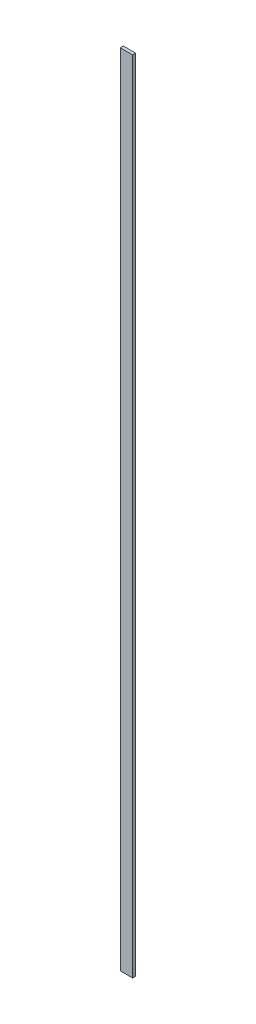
SolidWorks part; units mm, degrees
ref_plane "Přední" through (0, 0, 0) normal (0, 0, 1) x (1, 0, 0)
ref_plane "Horní" through (0, 0, 0) normal (0, 1, 0) x (1, 0, 0)
ref_plane "Pravá" through (0, 0, 0) normal (1, 0, 0) x (0, 0, -1)
sketch "Skica1" plane through (0, 0, 0) normal (0, 0, 1) x (1, 0, 0)
  line L0 (10, 650) -> (-10, -650) construction
  line L1 (-10, 650) -> (10, 650)
  line L2 (-10, 650) -> (-10, -650)
  line L3 (-10, -650) -> (10, -650)
  line L4 (10, 650) -> (10, -650)
  dimension "D1" = 1300
  dimension "D2" = 20
extrude "Extrude1" add sketch "Skica1" along normal blind 5
